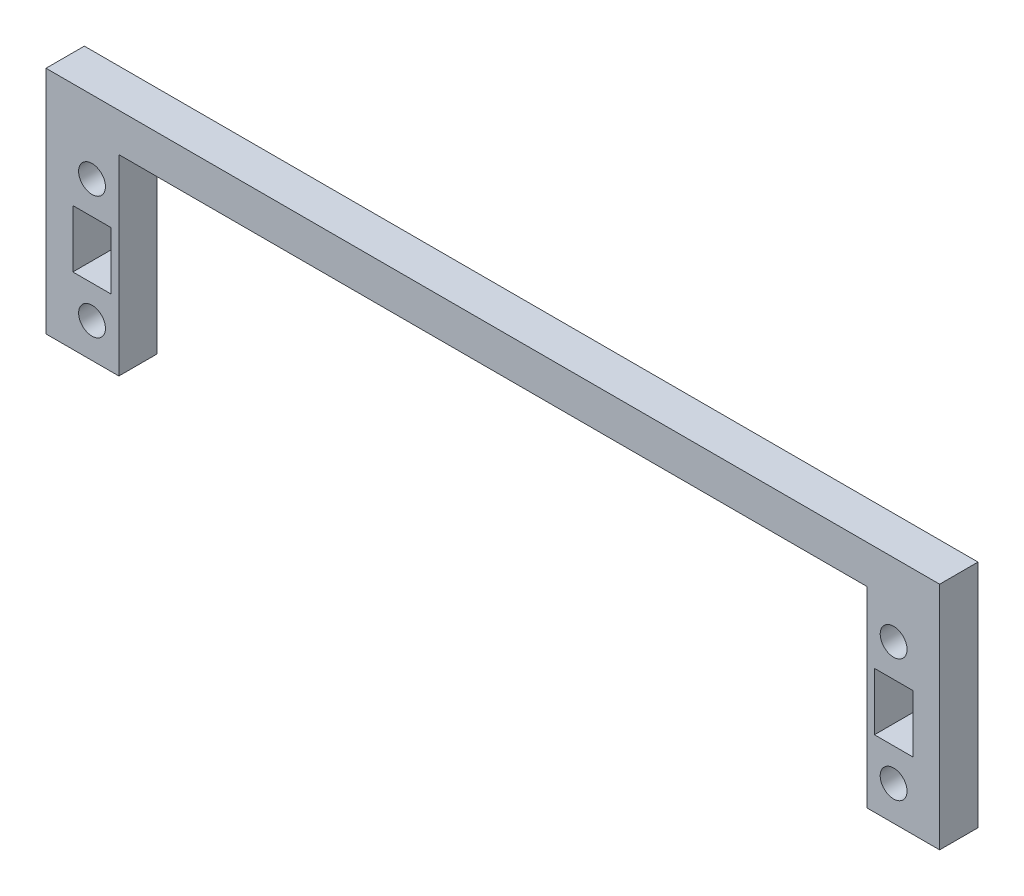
SolidWorks part; units mm, degrees
ref_plane "Front Plane" through (0, 0, 0) normal (0, 0, 1) x (1, 0, 0)
ref_plane "Top Plane" through (0, 0, 0) normal (0, 1, 0) x (1, 0, 0)
ref_plane "Right Plane" through (0, 0, 0) normal (1, 0, 0) x (0, 0, -1)
sketch "Sketch1" plane through (0, 0, 0) normal (0, 1, 0) x (1, 0, 0)
  line L0 (-60, 0) -> (0, 0) construction
  line L1 (0, -3.3) -> (0, 3.3) construction
  line L2 (-74.8, 0) -> (74.8, 0) construction
  circle A0 centre (-60, 0) radius 3
  circle A1 centre (60, 0) radius 3
  circle A2 centre (-60, 0) radius 8
  circle A3 centre (60, 0) radius 8
  dimension "D2" = 6
  dimension "D1" = 60
  dimension "D3" = 5
sketch "Sketch2" plane through (0, 0, 0) normal (0, 0, 1) x (1, 0, 0)
  line L0 (0, 25) -> (0, -25) construction
  line L1 (97.5, -25) -> (-97.5, -25)
  line L2 (-97.5, -25) -> (-97.5, 25)
  line L3 (-97.5, 25) -> (97.5, 25)
  line L4 (-97.5, 0) -> (97.5, 0) construction
  line L5 (-116.5, -25) -> (-116.5, 25)
  line L6 (-116.5, 25) -> (-97.5, 25)
  line L7 (-97.5, -25) -> (-116.5, -25)
  line L8 (-104.5, 25) -> (-104.5, -25) construction
  line L9 (-116.5, 0) -> (-97.5, 0) construction
  line L10 (-109.5, 7.5) -> (-99.5, 7.5)
  line L11 (-109.5, 7.5) -> (-109.5, -7.5)
  line L12 (-109.5, -7.5) -> (-99.5, -7.5)
  line L13 (-99.5, 7.5) -> (-99.5, -7.5)
  line L14 (-109.5, 0) -> (-99.5, 0) construction
  line L15 (-92.5, -25) -> (-92.5, 25)
  line L16 (-104.5, -25) -> (-104.5, 0) construction
  line L17 (104.5, -25) -> (104.5, 0) construction
  line L18 (109.5, 0) -> (99.5, 0) construction
  line L19 (116.5, 0) -> (97.5, 0) construction
  line L20 (104.5, 25) -> (104.5, -25) construction
  line L21 (92.5, -25) -> (92.5, 25)
  line L22 (99.5, 7.5) -> (99.5, -7.5)
  line L23 (109.5, -7.5) -> (99.5, -7.5)
  line L24 (109.5, 7.5) -> (109.5, -7.5)
  line L25 (109.5, 7.5) -> (99.5, 7.5)
  line L26 (97.5, -25) -> (116.5, -25)
  line L27 (116.5, 25) -> (97.5, 25)
  line L28 (116.5, -25) -> (116.5, 25)
  line L29 (97.5, -25) -> (97.5, 25)
  circle A0 centre (-104.5, 16) radius 3.5
  circle A2 centre (-104.5, -16) radius 3.5
  circle A3 centre (104.5, -16) radius 3.5
  circle A4 centre (104.5, 16) radius 3.5
  point P6 (0, 0)
  point P25 (0, 0)
  point P26 (-104.5, -23.4557)
  point P27 (0, 0)
  point P28 (0, 0)
  point P37 (0, 0)
  dimension "D4" = 16
  dimension "D5" = 7
  dimension "D1" = 97.5
  dimension "D2" = 50
  dimension "D3" = 19
  dimension "D6" = 10
  dimension "D7" = 2
  dimension "D8" = 7
  dimension "D9" = 15
  dimension "D10" = 5
extrude "Boss-Extrude1" add sketch "Sketch2" along normal blind 10 contours L7 L2 L6 L5 L10 L13 L12 L11 A0 A2 | L29 L26 L28 L27 L25 L24 L23 L22 A3 A4
sketch "Sketch3" plane through (0, 25, 0) normal (0, 1, 0) x (1, 0, 0)
  line L0 (-97.5, 0) -> (97.5, 0)
  line L1 (-97.5, -10) -> (97.5, -10)
  line L4 (-97.5, 0) -> (-116.5, 0)
  line L5 (-116.5, 0) -> (-116.5, -10)
  line L6 (-116.5, -10) -> (-97.5, -10)
  line L7 (-97.5, -10) -> (-97.5, 0)
  line L8 (-97.5, 0) -> (-116.5, 0)
  line L9 (-116.5, 0) -> (-116.5, -10)
  line L10 (-116.5, -10) -> (-97.5, -10)
  line L11 (-97.5, -10) -> (-97.5, 0)
  line L12 (116.5, 0) -> (97.5, 0)
  line L13 (97.5, 0) -> (97.5, -10)
  line L14 (97.5, -10) -> (116.5, -10)
  line L15 (116.5, -10) -> (116.5, 0)
  line L16 (116.5, 0) -> (97.5, 0)
  line L17 (97.5, 0) -> (97.5, -10)
  line L18 (97.5, -10) -> (116.5, -10)
  line L19 (116.5, -10) -> (116.5, 0)
  point P8 (97.5, -11.6448)
  dimension "D1" = 0
  dimension "D2" = 0
extrude "Boss-Extrude2" add sketch "Sketch3" along normal blind 10 contours L17 L0 L1 M12 | M12 M9 M10 M11 | L18 L19 L16 L17
